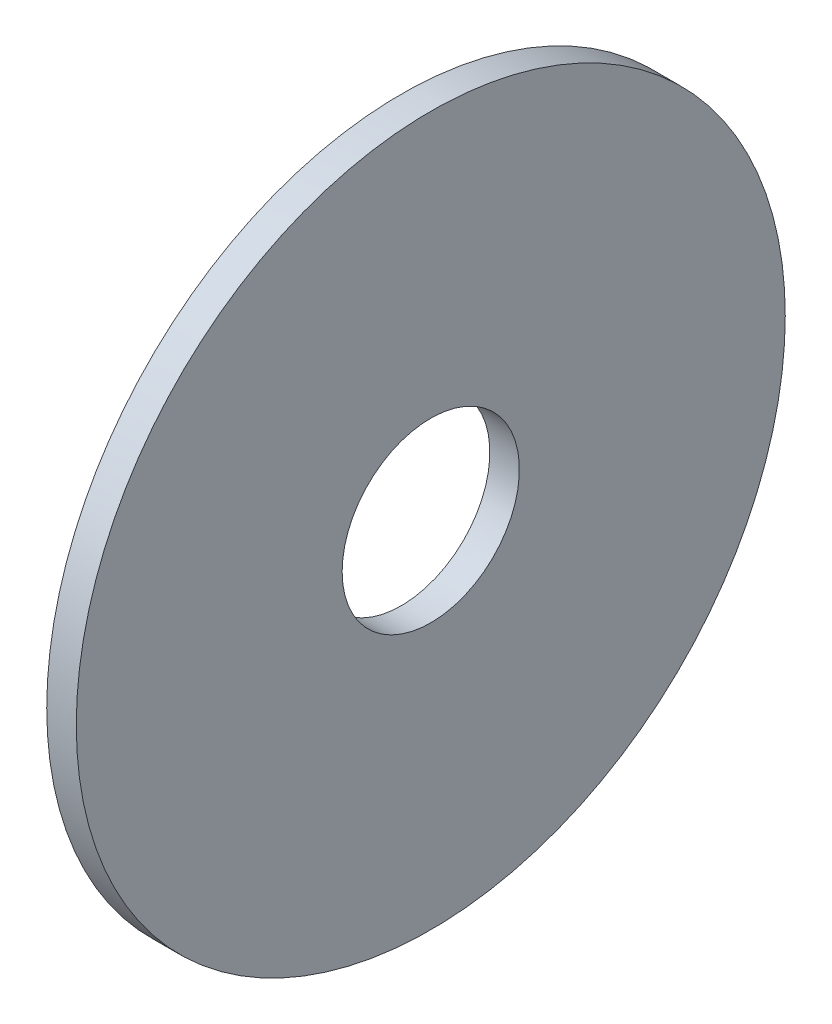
SolidWorks part; units mm, degrees
ref_plane "Front Plane" through (0, 0, 0) normal (0, 0, 1) x (1, 0, 0)
ref_plane "Top Plane" through (0, 0, 0) normal (0, 1, 0) x (1, 0, 0)
ref_plane "Right Plane" through (0, 0, 0) normal (1, 0, 0) x (0, 0, -1)
ref_plane "Plane1" through (0, 0, 0) normal (0, 0, -1) x (-1, 0, 0)
sketch "Sketch1" plane through (0, 0, 0) normal (0, 0, -1) x (-1, 0, 0)
  line L0 (-0.5, 12) -> (-0.5, 3)
  line L1 (-0.5, 3) -> (0.5, 3)
  line L2 (0.5, 3) -> (0.5, 12)
  line L3 (0.5, 12) -> (-0.5, 12)
  line L4 (-0.5, 0) -> (0.5, 0) construction
  dimension "D1" = 3
  dimension "D2" = 9
revolve "Revolve1" add sketch "Sketch1" angle 360 about L4
